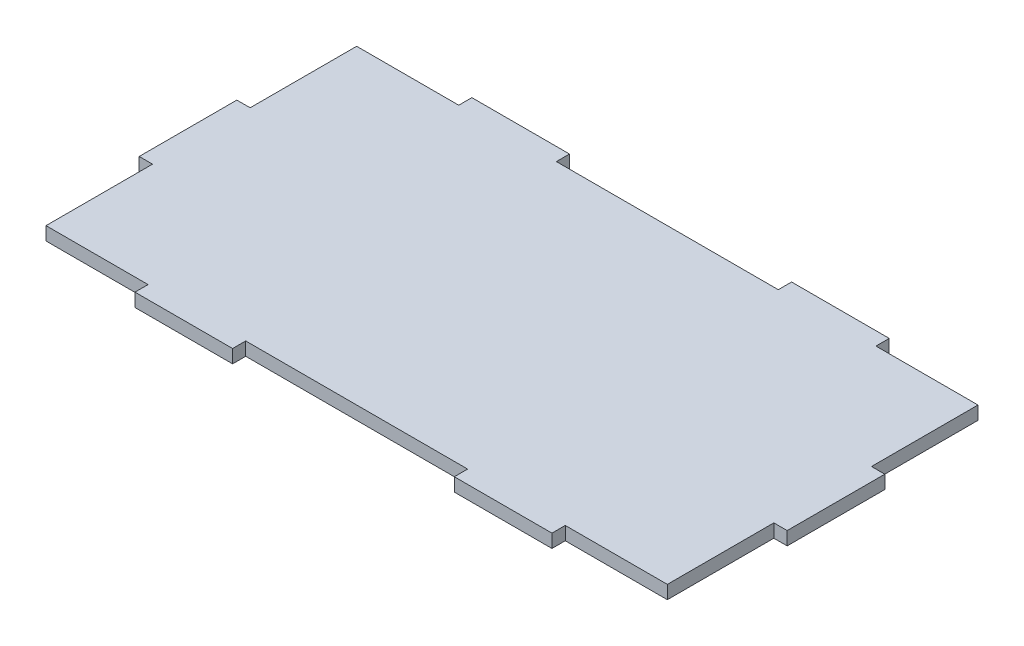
SolidWorks part; units mm, degrees
ref_plane "Front Plane" through (0, 0, 0) normal (0, 0, 1) x (1, 0, 0)
ref_plane "Top Plane" through (0, 0, 0) normal (0, 1, 0) x (1, 0, 0)
ref_plane "Right Plane" through (0, 0, 0) normal (1, 0, 0) x (0, 0, -1)
sketch "Sketch1" plane through (0, 0, 0) normal (0, 1, 0) x (1, 0, 0)
  line L0 (70.8046, -10.0646) -> (70.8046, -34.0646)
  line L1 (-69.1954, 35.9354) -> (-46.1954, 35.9354)
  line L2 (-69.1954, 35.9354) -> (-69.1954, 11.9354)
  line L3 (-69.1954, -34.0646) -> (-46.1954, -34.0646)
  line L4 (70.8046, 35.9354) -> (70.8046, 11.9354)
  line L5 (-69.1954, 11.9354) -> (-72.1954, 11.9354)
  line L6 (-69.1954, -10.0646) -> (-72.1954, -10.0646)
  line L7 (-72.1954, 11.9354) -> (-72.1954, -10.0646)
  line L8 (-69.1954, -10.0646) -> (-69.1954, -34.0646)
  line L9 (70.8046, -10.0646) -> (73.8046, -10.0646)
  line L10 (70.8046, 11.9354) -> (73.8046, 11.9354)
  line L11 (73.8046, 11.9354) -> (73.8046, -10.0646)
  line L12 (47.8046, -34.0646) -> (70.8046, -34.0646)
  line L13 (-46.1954, -34.0198) -> (-46.1954, -37.0198)
  line L14 (-46.1954, -37.0198) -> (-24.1954, -37.0198)
  line L15 (-24.1954, -34.0198) -> (-24.1954, -37.0198)
  line L16 (-24.1954, -34.0646) -> (25.8046, -34.0646)
  line L17 (25.8046, -34.0646) -> (25.8046, -37.0646)
  line L18 (25.8046, -37.0646) -> (47.8046, -37.0646)
  line L19 (47.8046, -34.0646) -> (47.8046, -37.0646)
  line L20 (47.8046, 35.9354) -> (47.8046, 38.9354)
  line L21 (25.8046, 38.9354) -> (47.8046, 38.9354)
  line L22 (25.8046, 35.9354) -> (25.8046, 38.9354)
  line L23 (-24.1954, 35.8907) -> (-24.1954, 38.8907)
  line L24 (-46.1954, 35.8907) -> (-46.1954, 38.8907)
  line L25 (-46.1954, 38.8907) -> (-24.1954, 38.8907)
  line L26 (-24.1954, 35.9354) -> (25.8046, 35.9354)
  line L27 (47.8046, 35.9354) -> (70.8046, 35.9354)
  dimension "D1" = 140
  dimension "D2" = 22
  dimension "D3" = 3
  dimension "D4" = 3
extrude "Boss-Extrude1" add sketch "Sketch1" along normal blind 3
